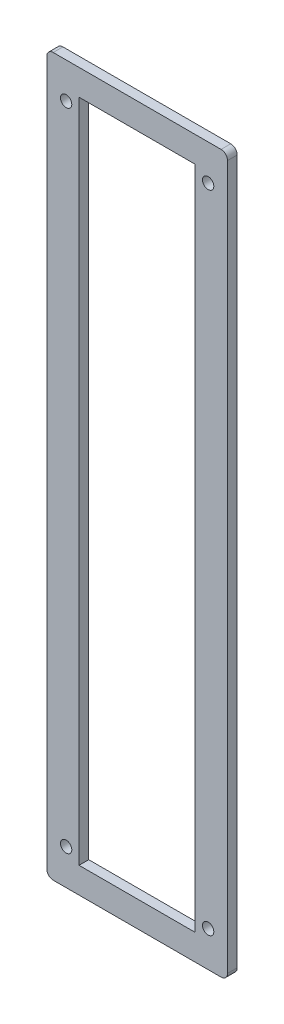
SolidWorks part; units mm, degrees
ref_plane "Front Plane" through (0, 0, 0) normal (0, 0, 1) x (1, 0, 0)
ref_plane "Top Plane" through (0, 0, 0) normal (0, 1, 0) x (1, 0, 0)
ref_plane "Right Plane" through (0, 0, 0) normal (1, 0, 0) x (0, 0, -1)
sketch "Sketch1" plane through (0, 0, 0) normal (0, 0, 1) x (1, 0, 0)
  line L1 (-44.444, 176.276) -> (44.456, 176.276)
  line L2 (-44.444, 176.276) -> (-44.444, -176.276)
  line L3 (-44.444, -176.276) -> (44.456, -176.276)
  line L4 (44.456, 176.276) -> (44.456, -176.276)
  point P10 (0.006, 176.276)
  point P14 (-44.444, 0)
  dimension "D1" = 352.552
  dimension "D2" = 88.9
  dimension "D3" = 0.006
  dimension "D4" = 176.276
extrude "Boss-Extrude1" add sketch "Sketch1" along normal blind 4.7752
sketch "Sketch2" plane through (0, 0, 4.7752) normal (0, 0, 1) x (1, 0, 0)
  line L0 (-44.444, 176.276) -> (-44.444, -176.276) construction
  line L1 (-28.575, 163.576) -> (28.575, 163.576)
  line L2 (-28.575, 163.576) -> (-28.575, -163.576)
  line L3 (-28.575, -163.576) -> (28.575, -163.576)
  line L4 (28.575, 163.576) -> (28.575, -163.576)
  line L5 (-44.444, -176.276) -> (44.456, -176.276) construction
  point P4 (-28.575, 0)
  point P5 (0, 163.576)
  dimension "D1" = 327.152
  dimension "D2" = 57.15
  dimension "D3" = 15.869
  dimension "D4" = 12.7
extrude "Cut-Extrude1" cut sketch "Sketch2" against normal through all
hole_wizard "7/32 (0.21875) Diameter Hole1" positions "Sketch3" profile "Sketch4" hole size "7/32" standard "ANSI Inch"
sketch "Sketch3" plane through (0, 0, 4.7752) normal (0, 0, 1) x (1, 0, 0)
  line L0 (-28.575, 163.576) -> (-28.575, -163.576) construction
  line L1 (28.575, 163.576) -> (-28.575, 163.576) construction
  point P0 (34.931, 158.7544)
  point P3 (-34.919, 158.7418)
  point P6 (34.931, -158.7582)
  point P9 (-34.919, -158.7582)
  dimension "D1" = 63.506
  dimension "D2" = 6.344
  dimension "D3" = 4.8216
  dimension "D4" = 4.8342
  dimension "D5" = 322.3342
sketch "Sketch4" plane through (34.931, 158.7544, 4.7752) normal (1, 0, 0) x (0, -1, 0)
  line L0 (0, 0) -> (0, 4.7752)
  line L1 (0, 4.7752) -> (2.7781, 4.7752)
  line L2 (2.7781, 4.7752) -> (2.7781, 0)
  line L5 (2.7781, 0) -> (0, 0)
  line L11 (0, -6.35) -> (0, 107.95) construction
  dimension "Thru Hole Dia." = 5.5562
  dimension "Thru Hole Depth" = 4.7752
fillet "Fillet1" radius 3.175 4 edges at (44.456, -176.276, 2.3876) (-44.444, -176.276, 2.3876) (-44.444, 176.276, 2.3876) (44.456, 176.276, 2.3876)
